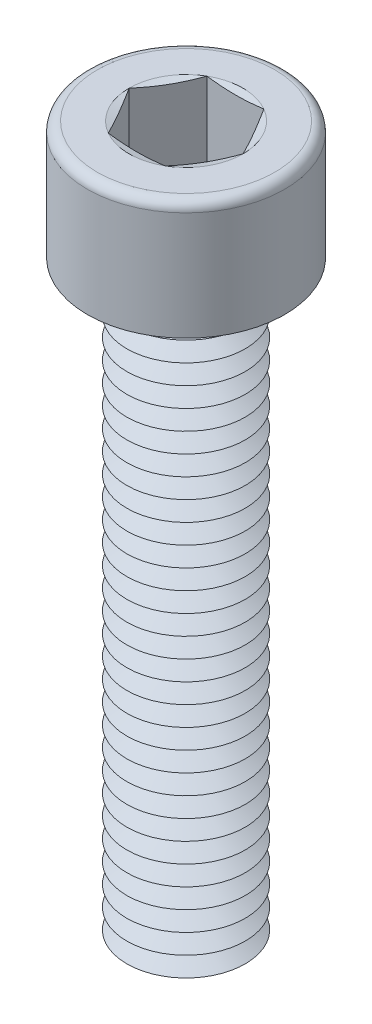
SolidWorks part; units mm, degrees
ref_plane "Front Plane" through (0, 0, 0) normal (0, 0, 1) x (1, 0, 0)
ref_plane "Top Plane" through (0, 0, 0) normal (0, 1, 0) x (1, 0, 0)
ref_plane "Right Plane" through (0, 0, 0) normal (1, 0, 0) x (0, 0, -1)
sketch "Sketch1" plane through (0, 0, 0) normal (0, 1, 0) x (1, 0, 0)
  circle A0 centre (0, 0) radius 3
  dimension "D1" = 6
extrude "Extrude1" add sketch "Sketch1" along normal blind 30
sketch "Sketch2" plane through (0, 30, 0) normal (0, 1, 0) x (1, 0, 0)
  circle A0 centre (0, 0) radius 5
  dimension "D1" = 10
extrude "Extrude2" add sketch "Sketch2" along normal blind 6
sketch "Sketch3" plane through (0, 36, 0) normal (0, 1, 0) x (1, 0, 0)
  line L1 (1.4434, 2.5) -> (-1.4434, 2.5)
  line L2 (-1.4434, 2.5) -> (-2.8868, 0)
  line L3 (-2.8868, 0) -> (-1.4434, -2.5)
  line L4 (-1.4434, -2.5) -> (1.4434, -2.5)
  line L5 (1.4434, -2.5) -> (2.8868, 0)
  line L6 (2.8868, 0) -> (1.4434, 2.5)
  circle A0 centre (0, 0) radius 2.5 construction
  dimension "D1" = 5
extrude "Extrude3" cut sketch "Sketch3" against normal blind 5
fillet "Fillet1" radius 0.5 1 edges at (0, 36, 5)
sketch "Sketch4" plane through (0, 0, 0) normal (1, 0, 0) x (0, 0, -1)
  line L0 (-2.5, 31) -> (0, 31)
  line L1 (0, 31) -> (0, 29.5566)
  line L2 (0, 29.5566) -> (-2.5, 31)
  dimension "D1" = 30
revolve "Cut-Revolve1" cut sketch "Sketch4" angle 360 about L1
sketch "Sketch5" plane through (0, 0, 0) normal (0, 0, 1) x (1, 0, 0)
  line L0 (-3, 0.5) -> (-3, -0.5)
  line L1 (-3, 30) -> (-3, 0) construction
  line L2 (-3, -0.5) -> (-2.134, 0)
  line L3 (-3, 0) -> (3, 0) construction
  line L4 (-2.134, 0) -> (-3, 0.5)
  dimension "D1" = 1
revolve "Cut-Revolve2" cut sketch "Sketch5" angle 360 about axis through (0, 30, 0) along (0, -1, 0)
pattern_linear "LPattern1" count 30 spacing 1 along (0, 1, 0) of "Cut-Revolve2"
sketch "Sketch6" plane through (0, 36, 0) normal (0, 1, 0) x (1, 0, 0)
  circle A0 centre (0, 0) radius 2.8868
extrude "Extrude4" cut sketch "Sketch6" against normal through all draft 75
